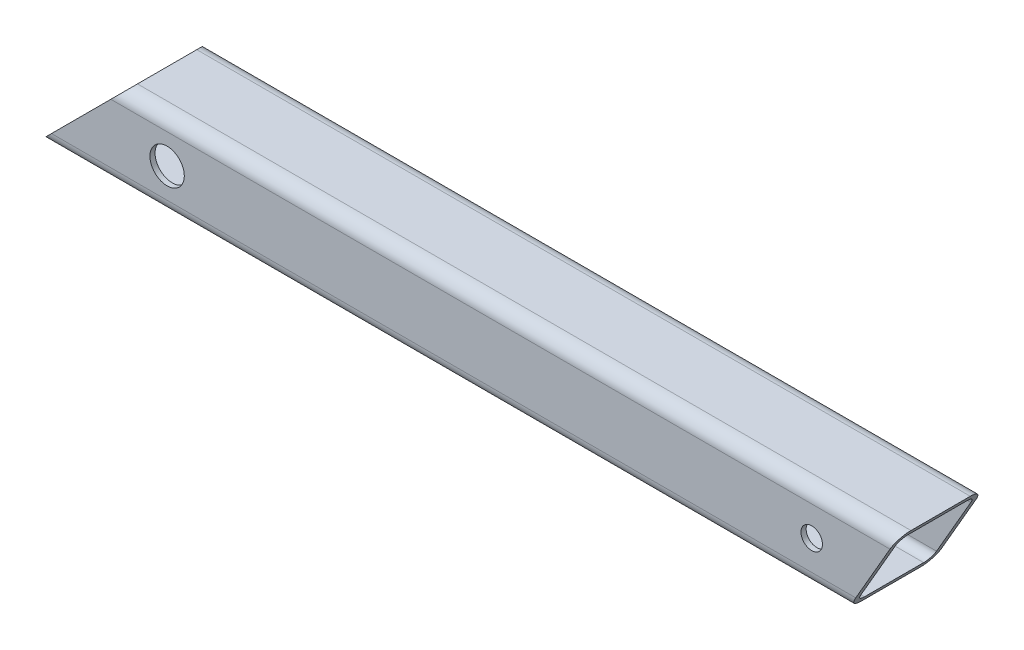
SolidWorks part; units mm, degrees
ref_plane "Front Plane" through (0, 0, 0) normal (0, 0, 1) x (1, 0, 0)
ref_plane "Top Plane" through (0, 0, 0) normal (0, 1, 0) x (1, 0, 0)
ref_plane "Right Plane" through (0, 0, 0) normal (1, 0, 0) x (0, 0, -1)
sketch "Member Sketch" plane through (0, 0, 0) normal (0, 1, 0) x (1, 0, 0)
  line L0 (0, 0) -> (1000, 0)
  line L2 (0, 0) -> (1000, 0) construction
other "Structural Member1"
ref_plane "Plane1" through (0, 0, 0) normal (1, 0, 0) x (0, 0, -1)
sketch "Sketch12" plane through (0, 0, 0) normal (1, 0, 0) x (0, 0, -1)
  line L0 (0, 50) -> (0, -50) construction
  line L1 (-50, 0) -> (50, 0) construction
  line L2 (-34.5, 50) -> (34.5, 50)
  line L3 (50, 34.5) -> (50, -34.5)
  line L4 (-50, 34.5) -> (-50, -34.5)
  line L5 (-34.5, -50) -> (34.5, -50)
  line L6 (-34.5, 44) -> (34.5, 44)
  line L7 (44, 34.5) -> (44, -34.5)
  line L8 (-34.5, -44) -> (34.5, -44)
  line L9 (-44, 34.5) -> (-44, -34.5)
  arc A0 (34.5, 50) -> (50, 34.5) centre (34.5, 34.5) cw
  arc A1 (-34.5, 50) -> (-50, 34.5) centre (-34.5, 34.5) ccw
  arc A2 (-34.5, -50) -> (-50, -34.5) centre (-34.5, -34.5) cw
  arc A3 (34.5, -50) -> (50, -34.5) centre (34.5, -34.5) ccw
  arc A4 (34.5, 44) -> (44, 34.5) centre (34.5, 34.5) cw
  arc A5 (34.5, -44) -> (44, -34.5) centre (34.5, -34.5) ccw
  arc A6 (-34.5, -44) -> (-44, -34.5) centre (-34.5, -34.5) cw
  arc A7 (-34.5, 44) -> (-44, 34.5) centre (-34.5, 34.5) ccw
  point P7 (0, 0)
  point P29 (-50, 50)
  point P30 (50, 50)
  point P31 (50, -50)
  point P32 (-50, -50)
  dimension "RADIUS" = 15.5
  dimension "WIDTH" = 100
  dimension "HEIGHT" = 100
  dimension "WALL THK" = 6
sketch "Sketch13" plane through (0, 0, 0) normal (0, 0, 1) x (1, 0, 0)
  line L0 (0, -50) -> (100, 50)
  line L1 (1000, 50) -> (0, 50) construction
  line L4 (0, 34.5) -> (0, -34.5) construction
  dimension "D1" = 45
extrude "Cut-Extrude2" cut sketch "Sketch13" against normal through all and the other way through all
sketch "Sketch14" plane through (0, 0, 0) normal (0, 0, 1) x (1, 0, 0)
  line L0 (1000, 50) -> (942.265, -50)
  line L1 (1000, -50) -> (0, -50) construction
  line L2 (1000, 34.5) -> (1000, -34.5) construction
  dimension "D1" = 30
extrude "Cut-Extrude5" cut sketch "Sketch14" against normal through all and the other way through all
sketch "Sketch15" plane through (0, 0, 50) normal (0, 0, 1) x (1, 0, 0)
  line L0 (0, 0) -> (1000, 0) construction
  circle A0 centre (150, 0) radius 20
  circle A1 centre (900, 0) radius 12.5
  dimension "D1" = 40
  dimension "D2" = 25
  dimension "D3" = 100
  dimension "D4" = 150
extrude "Cut-Extrude6" cut sketch "Sketch15" against normal through all
